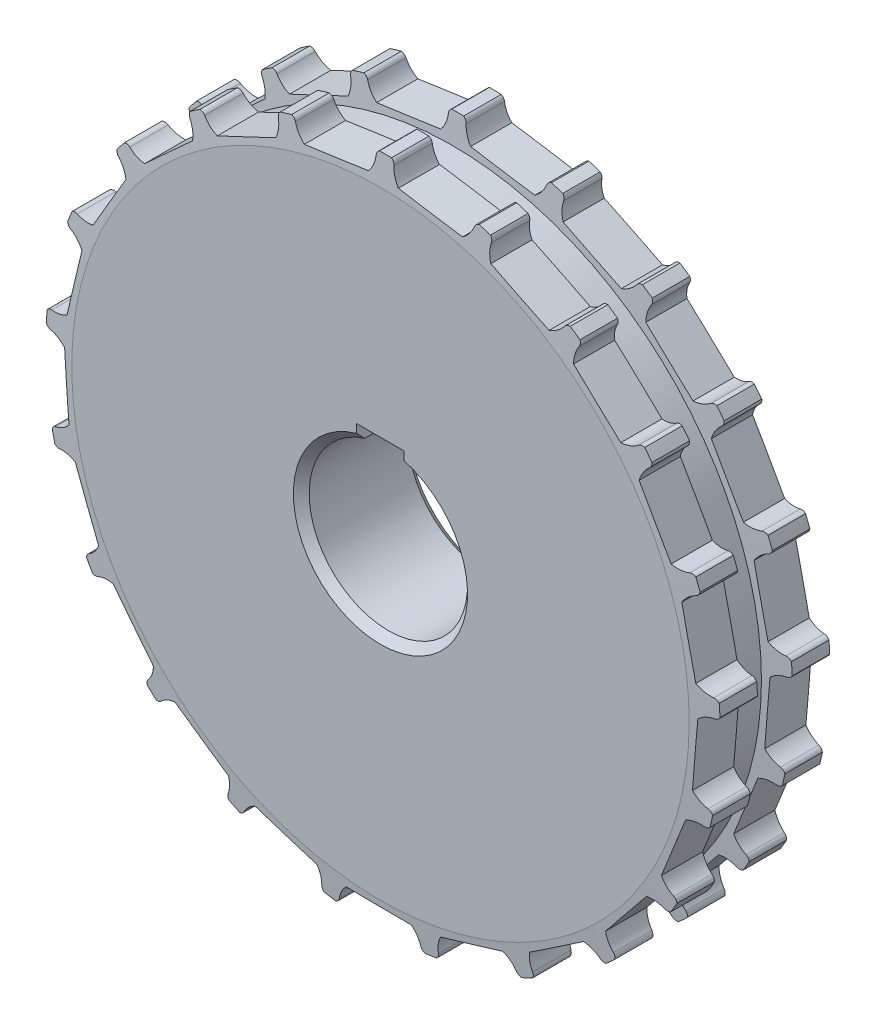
SolidWorks part; units mm, degrees
ref_plane "Alzado" through (0, 0, 0) normal (0, 0, 1) x (1, 0, 0)
ref_plane "Planta" through (0, 0, 0) normal (0, 1, 0) x (1, 0, 0)
ref_plane "Vista lateral" through (0, 0, 0) normal (1, 0, 0) x (0, 0, -1)
sketch "Croquis1" plane through (0, 0, 0) normal (0, 0, 1) x (1, 0, 0)
  circle A0 centre (0, 0) radius 85.25
  circle A1 centre (0, 0) radius 20
  dimension "D1" = 170.5
  dimension "D2" = 40
extrude "Extruir1" add sketch "Croquis1" along normal mid plane 29
sketch "Croquis2" plane through (0, 0, 0) normal (0, 0, 1) x (1, 0, 0)
  circle A0 centre (0, 0) radius 85.25 construction
  circle A1 centre (0, 0) radius 85.25
  circle A2 centre (0, 0) radius 78
  dimension "D1" = 156
extrude "Cortar-Extruir1" cut sketch "Croquis2" against normal mid plane 7.5
chamfer "Chaflán1" distance 2 angle 45 2 edges at (20, 0, -14.5) (20, 0, 14.5)
chamfer "Chaflán2" distance 7.25 angle 5 2 edges at (85.25, 0, 3.75) (85.25, 0, -14.5)
chamfer "Chaflán3" distance 7.25 angle 5 2 edges at (85.25, 0, -3.75) (85.25, 0, 14.5)
sketch "Croquis3" plane through (0, 0, 0) normal (0, 0, 1) x (1, 0, 0)
  line L0 (0, 0) -> (0, 88.3104) construction
  line L1 (0, 0) -> (25.964, 84.1733) construction
  line L2 (0, 0) -> (51.1995, 75.0959) construction
  line L3 (0, 0) -> (70.8056, 56.4656) construction
  line L4 (0, 0) -> (89.3387, 35.0629) construction
  line L5 (0, 0) -> (90.9763, 6.8177) construction
  line L6 (0, 0) -> (96.6374, -22.0569) construction
  line L7 (0, 0) -> (79.4662, -45.8799) construction
  line L8 (0, 0) -> (69.9769, -75.4172) construction
  line L9 (0, 0) -> (42.2237, -87.6784) construction
  line L10 (0, 0) -> (13.5666, -90.0083) construction
  line L11 (0, 0) -> (-13.8992, -92.215) construction
  line L12 (0, 0) -> (-42.0575, -87.3333) construction
  line L13 (0, 0) -> (-64.6149, -69.6383) construction
  line L14 (0, 0) -> (-85.1943, -49.1869) construction
  line L15 (0, 0) -> (-90.8337, -20.7322) construction
  line L16 (0, 0) -> (-96.1372, 7.2045) construction
  line L17 (0, 0) -> (-88.1434, 34.5937) construction
  line L18 (0, 0) -> (-69.9567, 55.7886) construction
  line L19 (0, 0) -> (-52.7361, 77.3497) construction
  line L20 (0, 0) -> (-28.1707, 91.3272) construction
  dimension "D1" = 17.143
  dimension "D2" = 17.143
  dimension "D3" = 17.143
  dimension "D4" = 17.143
  dimension "D5" = 17.143
  dimension "D6" = 17.143
  dimension "D7" = 17.143
  dimension "D8" = 17.143
  dimension "D9" = 17.143
  dimension "D10" = 17.143
  dimension "D11" = 17.143
  dimension "D12" = 17.143
  dimension "D13" = 17.143
  dimension "D14" = 17.143
  dimension "D15" = 17.143
  dimension "D16" = 17.143
  dimension "D17" = 17.143
  dimension "D18" = 17.143
  dimension "D19" = 17.143
  dimension "D20" = 17.143
  dimension "D21" = 17.143
sketch "Croquis5" plane through (0, 0, 0) normal (0, 0, 1) x (1, 0, 0)
  line L0 (24.3442, 81.7235) -> (28.251, 82.483)
  line L1 (7.1439, 75.8346) -> (-12.5, 75.8346) construction
  line L2 (32.2251, 107.5746) -> (28.251, 82.483)
  line L3 (4.3529, 79.9015) -> (20.551, 77.336)
  line L4 (2.1013, 85.2465) -> (-1.3797, 87.176)
  line L5 (7.1439, 75.8346) -> (-12.5, 75.8346) construction
  line L6 (2.5945, 112.2676) -> (-1.3797, 87.176)
  line L8 (2.5945, 112.2676) -> (32.2251, 107.5746)
  line L9 (0, 0) -> (17.4098, 109.9211) construction
  circle A0 centre (0, 0) radius 83.75 construction
  arc A1 (23.2196, 80.7607) -> (20.551, 77.336) centre (16.636, 83.1388) cw
  arc A2 (2.8732, 83.9832) -> (4.3529, 79.9015) centre (9.8696, 84.2105) ccw
  arc A3 (24.3442, 81.7235) -> (23.2196, 80.7607) centre (24.6304, 80.2511) ccw
  arc A4 (4.4, 80.2889) -> (5.8443, 76.0305) centre (11.4, 80.2889) ccw construction
  circle A5 centre (0, 0) radius 84.5 construction
  arc A6 (4.4, 80.2889) -> (6, 75.8346) centre (11.4, 80.2889) ccw construction
  circle A7 centre (0, 0) radius 78
  arc A8 (-4.2401, 77.8847) -> (8.1791, 77.57) centre (0, 0) ccw construction
  arc A9 (2.1013, 85.2465) -> (2.8732, 83.9832) centre (1.374, 83.9346) cw
  circle A10 centre (0, 0) radius 80.02 construction
  circle A11 centre (0, 0) radius 85.25 construction
  arc A13 (13.336, 84.2004) -> (24.2983, 81.7139) centre (0, 0) ccw construction
  point P22 (12.452, 78.6188)
  point P42 (13.9148, 74.3531)
  point P43 (13.8499, 74.3652)
  dimension "D3" = 1.5
  dimension "D6" = 0
  dimension "D7" = 16.4
  dimension "D5" = 167.5
  dimension "D11" = 4.9269
  dimension "D12" = 6.2881
  dimension "D1" = 15
  dimension "D2" = 7
  dimension "D9" = 3.8
  dimension "D10" = 20
  dimension "D4" = 169
  dimension "D13" = 22.5202
  dimension "D8" = 20.6
  dimension "D14" = 5.6513
  dimension "D15" = 160.04
extrude "Cortar-Extruir2" cut sketch "Croquis5" against normal through all and the other way through all
pattern_circular "MatrizC1" count 21 over 360 about axis through (0, 0, 0) along (0, 0, 1) of "Cortar-Extruir2"
sketch "Croquis7" plane through (0, 0, 0) normal (0, 0, 1) x (1, 0, 0)
  circle A0 centre (0, 0) radius 85.2 construction
  dimension "D1" = 170.4
sketch "Croquis8" plane through (0, 0, 0) normal (0, 0, 1) x (1, 0, 0)
  line L0 (0, -20) -> (0, 23.3) construction
  line L1 (-6, 23.3) -> (6, 23.3)
  line L2 (-6, 23.3) -> (-6, 18.3)
  line L3 (6, 23.3) -> (6, 18.3)
  line L4 (-6, 18.3) -> (6, 18.3)
  circle A0 centre (0, 0) radius 20 construction
  point P8 (0, 23.3)
  dimension "D1" = 43.3
  dimension "D2" = 12
  dimension "D3" = 5
extrude "Cortar-Extruir3" cut sketch "Croquis8" against normal through all both and the other way through all
